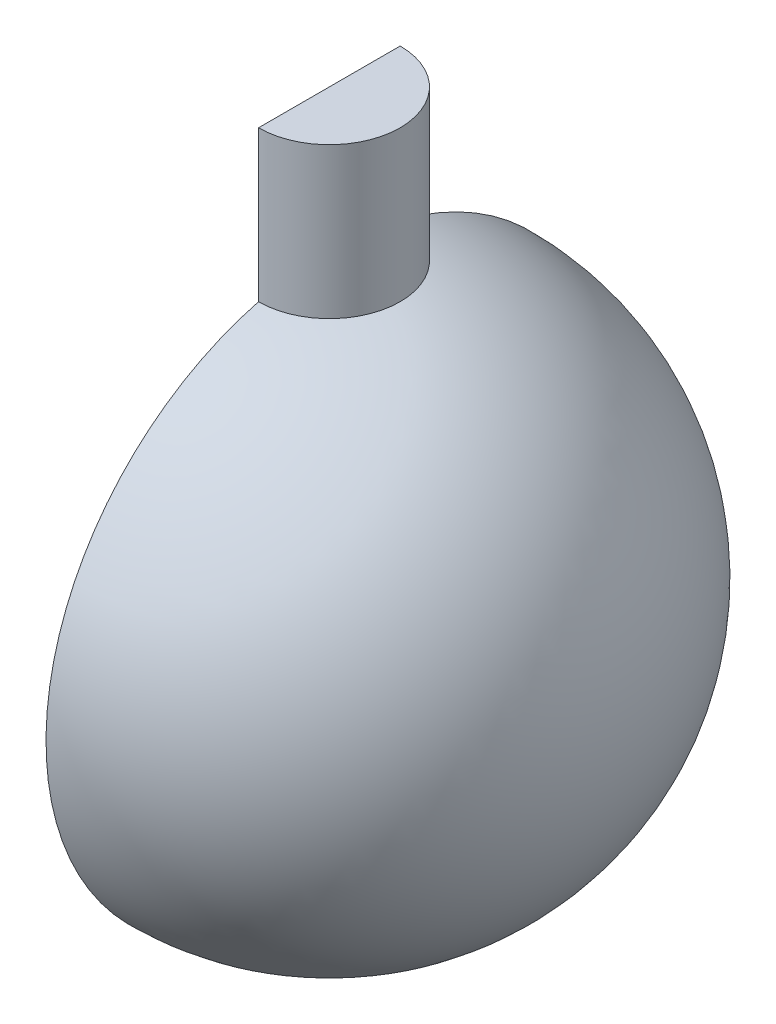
SolidWorks part; units mm, degrees
ref_plane "Front Plane" through (0, 0, 0) normal (0, 0, 1) x (1, 0, 0)
ref_plane "Top Plane" through (0, 0, 0) normal (0, 1, 0) x (1, 0, 0)
ref_plane "Right Plane" through (0, 0, 0) normal (1, 0, 0) x (0, 0, -1)
sketch "Sketch1" plane through (0, 0, 0) normal (0, 0, 1) x (1, 0, 0)
  line L0 (0, -38.1) -> (0, 38.1) construction
  line L1 (0, -38.1) -> (0, -29.6333)
  line L2 (0, 29.6333) -> (0, 38.1)
  arc A0 (0, 29.6333) -> (0, -29.6333) centre (0, 0) ccw
  arc A1 (0, -38.1) -> (0, 38.1) centre (0, 0) cw
  dimension "D1" = 29.6333
  dimension "D2" = 8.4667
revolve "Revolve2" add sketch "Sketch1" angle 360 about L0
ref_plane "Plane1" through (0, 57.15, 0) normal (0, 1, 0) x (1, 0, 0)
sketch "Sketch3" plane through (0, 57.15, 0) normal (0, 1, 0) x (1, 0, 0)
  circle A0 centre (0, 0) radius 9.525
  dimension "D1" = 19.05
extrude "Boss-Extrude1" add sketch "Sketch3" against normal up to surface (20.2598 mm away)
sketch "Sketch2" plane through (0, 0, 0) normal (1, 0, 0) x (0, 0, -1)
  line L0 (-76.2, -76.2) -> (-76.2, 76.2)
  line L1 (-76.2, -76.2) -> (76.2, -76.2)
  line L2 (-76.2, 76.2) -> (76.2, 76.2)
  line L3 (76.2, -76.2) -> (76.2, 76.2)
  line L4 (-76.2, -76.2) -> (76.2, 76.2) construction
  line L5 (-76.2, 76.2) -> (76.2, -76.2) construction
  point P1 (0, 0)
  dimension "D1" = 152.4
extrude "Cut-Extrude1" cut sketch "Sketch2" against normal through all
